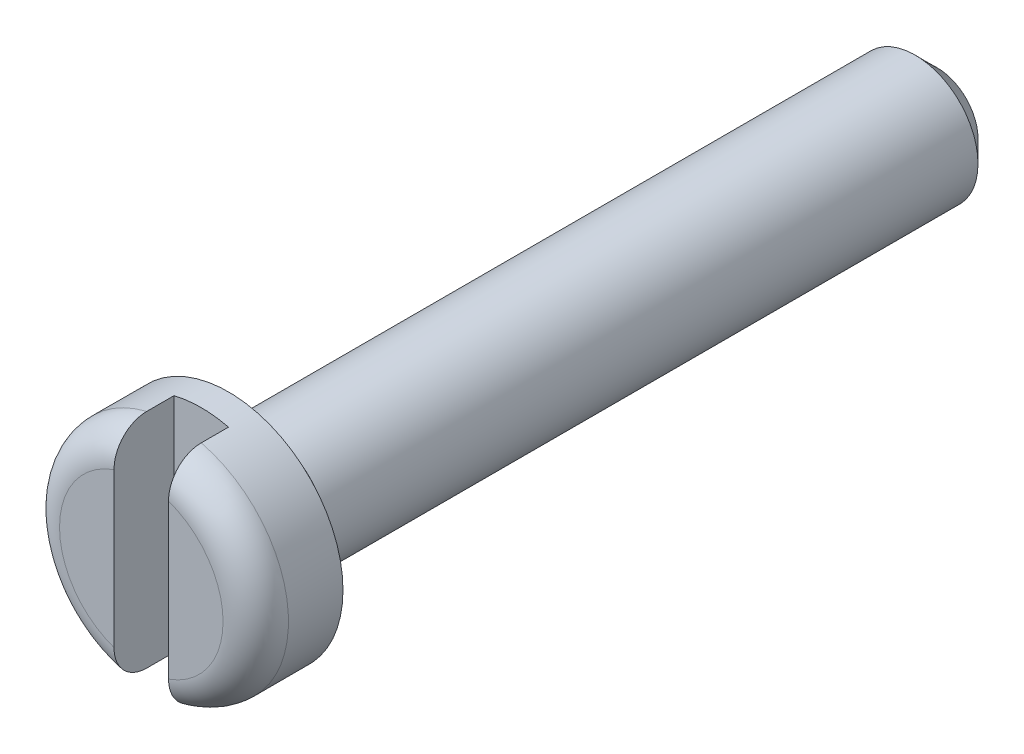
SolidWorks part; units mm, degrees
ref_plane "Face" through (0, 0, 0) normal (0, 0, 1) x (1, 0, 0)
ref_plane "Dessus" through (0, 0, 0) normal (0, 1, 0) x (1, 0, 0)
ref_plane "Droite" through (0, 0, 0) normal (1, 0, 0) x (0, 0, -1)
sketch "Esquisse1" plane through (0, 0, 0) normal (0, 0, 1) x (1, 0, 0)
  circle A0 centre (0, 0) radius 2.1
extrude "Base-Extrusion" add sketch "Esquisse1" along normal blind 1.6
fillet "Congé1" radius 0.6 1 edges at (2.1, 0, 1.6)
sketch "Esquisse2" plane through (0, 0, 0) normal (0, 0, -1) x (-1, 0, 0)
  circle A0 centre (0, 0) radius 1.15
extrude "Boss.-Extru.1" add sketch "Esquisse2" along normal blind 13
chamfer "Chanfrein1" distance 0.4 angle 45 1 edges at (-1.15, 0, -13)
sketch "Esquisse3" plane through (0, 0, 0) normal (0, 1, 0) x (1, 0, 0)
  line L0 (0, -0.1018) -> (0, 6.3871) construction
  line L1 (-1.6277, 0) -> (2.954, 0) construction
  line L2 (2.3056, 0) -> (0.75, 0)
  line L3 (0.75, 6) -> (0.75, -2.0309) construction
  line L4 (0.75, 0) -> (0.75, 0.2113)
  line L5 (1.5043, 1.0854) -> (2.3056, 0)
  line L6 (0.75, 0.2113) -> (1.5043, 1.0854)
revolve "Enlèvement de matière-Révolution1" cut sketch "Esquisse3" angle 360 about L0
sketch "Esquisse4" plane through (0, 0, 0) normal (0, 1, 0) x (1, 0, 0)
  line L0 (0, -1.8227) -> (0, 6.2884) construction
  line L1 (-1.6716, 0) -> (4.083, 0) construction
  line L2 (-0.8056, -1.5815) -> (4.2803, -1.5815) construction
  line L3 (-0.9481, -0.5) -> (3.6445, -0.5) construction
  line L4 (0.5, -0.4197) -> (0.5, -1.7569) construction
  line L5 (-0.5, -0.321) -> (-0.5, -1.9761) construction
  line L7 (-0.5, -0.5) -> (0.5, -0.5)
  line L8 (-0.5, -0.5) -> (-0.5, -1.8227)
  line L9 (-0.5, -1.8227) -> (0.5, -1.8227)
  line L10 (0.5, -0.5) -> (0.5, -1.8227)
extrude "Enlèv. mat.-Extru.1" cut sketch "Esquisse4" against normal mid plane 6
